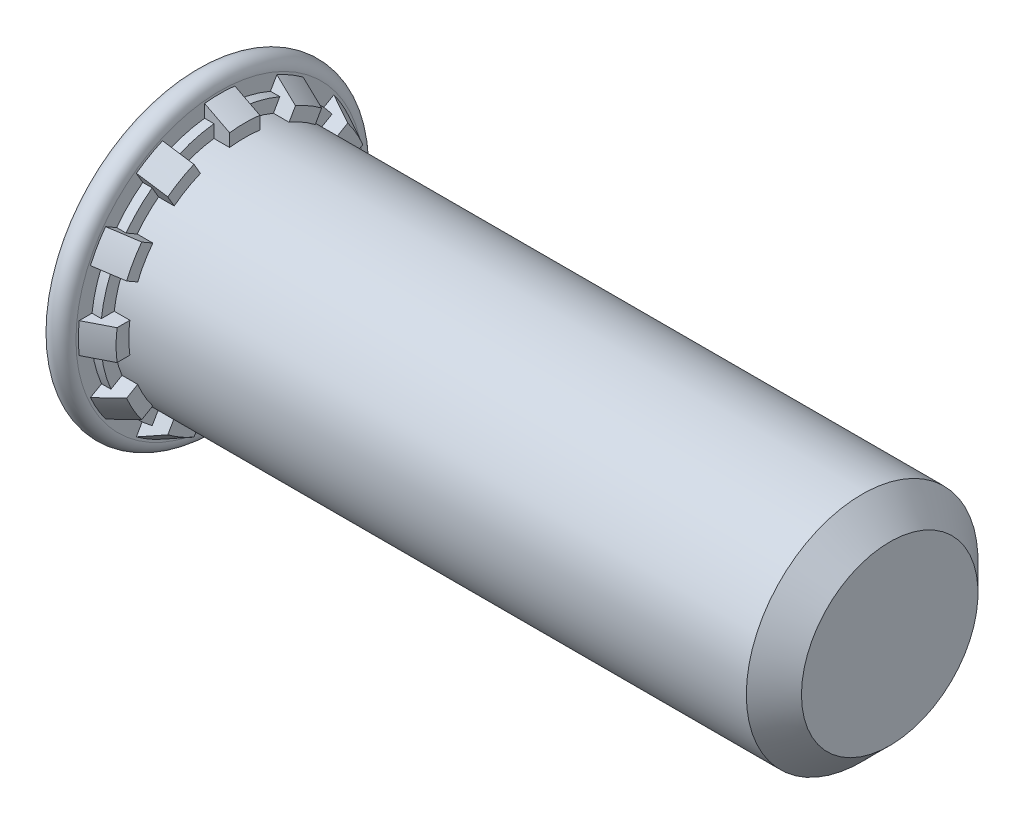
SolidWorks part; units mm, degrees
revolve "BaseBody" add sketch "BodySke" angle 360 about L6
sketch "BodySke" plane through (0, 0, 0) normal (0, 0, 1) x (1, 0, 0)
  line L0 (0, 0) -> (0, 3.9345)
  line L1 (0.6858, 3.9395) -> (0.6858, 3.8735)
  line L2 (0.6858, 3.8735) -> (1.3716, 3.5242)
  line L3 (1.3716, 3.175) -> (18.2943, 3.175)
  line L4 (19.05, 2.4193) -> (19.05, 0)
  line L5 (19.05, 0) -> (0, 0)
  line L6 (0, 0) -> (50.554, 0) construction
  line L7 (1.3716, 3.5242) -> (1.3716, 3.175)
  line L8 (19.05, 2.4193) -> (18.2943, 3.175)
  line L9 (-9.525, 4.2799) -> (9.525, 4.2799) construction
  line L11 (2.6416, 19.05) -> (2.6416, -3.175) construction
  line L13 (9.525, -4.2799) -> (-9.525, -4.2799) construction
  line L14 (0.0051, 3.9395) -> (0.0051, 3.9345)
  line L15 (0, 3.9345) -> (0.0051, 3.9345)
  arc A0 (0.0051, 3.9395) -> (0.6858, 3.9395) centre (0.3454, 3.9395) cw
extrude "RibCut1" cut sketch "RibCut1Ske" against normal blind 0.4286
sketch "RibCut1Ske" plane through (1.3716, 0, 0) normal (1, 0, 0) x (0, 0, -1)
  line L0 (0.4144, 3.1478) -> (0.4144, 4.2598)
  line L1 (1.215, 2.9333) -> (1.771, 3.8963)
  line L2 (0, 0) -> (0, 4.9784) construction
  line L3 (0, 0) -> (0.4144, 3.1478) construction
  line L4 (0, 0) -> (1.215, 2.9333) construction
  arc A1 (1.215, 2.9333) -> (0.4144, 3.1478) centre (0, 0) ccw
  arc A2 (1.771, 3.8963) -> (0.4144, 4.2598) centre (0, 0) ccw
ref_plane "Plane1" through (0, 0, 0) normal (0, 0, 1) x (1, 0, 0)
ref_plane "Plane2" through (0, 0, 0) normal (0, 1, 0) x (1, 0, 0)
ref_plane "Plane3" through (0, 0, 0) normal (1, 0, 0) x (0, 0, -1)
other "Configuration Table"
sketch "ThdSchSke" plane through (0, 0, 0) normal (0, 0, 1) x (1, 0, 0)
  line L0 (3.429, -2.4193) -> (2.8999, -3.175)
  line L1 (3.429, -2.4193) -> (3.9581, -3.175)
  line L2 (3.9581, -3.175) -> (3.9581, -3.9688)
  line L3 (-3.175, 0) -> (5.1513, 0) construction
  line L5 (3.9581, -3.9688) -> (2.8999, -3.9688)
  line L6 (2.8999, -3.9688) -> (2.8999, -3.175)
  line L7 (0, 3.9345) -> (0, -3.9345) construction
revolve "ThreadSchematic" [suppressed] cut sketch "ThdSchSke" angle 360 about L3
pattern_linear "ThdSchPat" [suppressed]
sketch "RibCut2Ske" plane through (1.3716, 0, 0) normal (1, 0, 0) x (0, 0, -1)
  line L0 (0.4144, 3.4998) -> (0.4144, 4.2598)
  line L1 (1.391, 3.2381) -> (1.771, 3.8963)
  line L2 (0.4144, 3.1478) -> (0.4144, 4.9596) construction
  line L3 (0, 0) -> (0, 5.0239) construction
  line L4 (0, 0) -> (0.4144, 3.1478) construction
  line L5 (0, 0) -> (1.215, 2.9333) construction
  line L6 (1.215, 2.9333) -> (2.1244, 4.5085) construction
  arc A1 (1.391, 3.2381) -> (0.4144, 3.4998) centre (0, 0) ccw
  arc A2 (1.771, 3.8963) -> (0.4144, 4.2598) centre (0, 0) ccw
  circle A4 centre (0, 0) radius 3.175 construction
extrude "RibCut2" cut sketch "RibCut2Ske" against normal blind 0.6858
pattern_circular "RibCutsPat" count 12 every 30 about axis through (0, 0, 0) along (1, 0, 0) of "RibCut2", "RibCut1"
equation "' \"Length@BodySke\" = 0.75"
equation "' \"H_dia@BodySke\" = 0.337"
equation "' \"Start@ThdSchSke\" = 0.135"
equation "' \"Diameter@BodySke\" = 0.25"
equation "' \"Minor_dia@BodySke\" =0.1905"
equation "' \"Minor_dia@BodySke\" = 0.1905"
equation "' \"Advance@BodySke\" = 0.05"
equation "\"T_dim@BodySke\" = \"Start@ThdSchSke\" * 0.2"
equation "\"Shoulder_ht@BodySke\" = \"Start@ThdSchSke\" * 0.4"
equation "\"Shoulder_lower_dia@BodySke\" = \"H_dia@BodySke\" - \"Start@ThdSchSke\" * 0.2 - .005"
equation "\"Shoulder_upper_dia@BodySke\" = ( \"Shoulder_lower_dia@BodySke\" + \"Diameter@BodySke\" ) /2"
equation "\"Num_ribs@RibCutsPat\" = 12"
equation "\"Angle@RibCutsPat\" = 360 / \"Num_ribs@RibCutsPat\""
equation "\"Angle@RibCut1Ske\" =\"Angle@RibCutsPat\""
equation "\"Rib_root_half_angle@RibCut1Ske\" = \"Angle@RibCut1Ske\" / 4"
equation "\"Rib_root_gap_angle@RibCut1Ske\" = \"Angle@RibCut1Ske\" - (2 * \"Rib_root_half_angle@RibCut1Ske\" )"
equation "\"Inner_dia@RibCut1Ske\" = \"Diameter@BodySke\""
equation "\"Outer_dia@RibCut1Ske\" = \"H_dia@BodySke\""
equation "\"Depth@RibCut1\" =  \"Start@ThdSchSke\" * 0.125"
equation "\"Angle@RibCut2Ske\" =\"Angle@RibCutsPat\""
equation "\"Rib_root_half_angle@RibCut2Ske\" = \"Angle@RibCut1Ske\" / 4"
equation "\"Rib_root_gap_angle@RibCut2Ske\" = \"Angle@RibCut1Ske\" - (2 * \"Rib_root_half_angle@RibCut1Ske\" )"
equation "\"Rib_root_dia@RibCut2Ske\" = \"Diameter@BodySke\""
equation "\"Inner_dia@RibCut2Ske\" = \"Shoulder_upper_dia@BodySke\""
equation "\"Outer_dia@RibCut2Ske\" = \"H_dia@BodySke\""
equation "\"Depth@RibCut2\" =  \"Start@ThdSchSke\" * 0.2"
equation "\"Thread_length@ThreadCosmetic\" = \"Length@BodySke\" - \"Start@ThdSchSke\""
equation "\"Thread_minor@ThreadCosmetic\" = \"Minor_dia@BodySke\""
equation "\"Thread_minor@ThdSchSke\" = \"Minor_dia@BodySke\""
equation "\"Diameter@ThdSchSke\" = \"Diameter@BodySke\""
equation "\"Overcut@ThdSchSke\" = \"Diameter@BodySke\" * 1.25"
equation "\"Num_threads@ThdSchPat\" = int( \"Thread_length@ThreadCosmetic\" / \"Advance@BodySke\" + 0.999 )  + 1"
equation "\"Advance@ThdSchPat\" = \"Thread_length@ThreadCosmetic\" /  (\"Num_threads@ThdSchPat\" - 1) 'relax it"
equation "\"Num_threads@ThdSchPat\" = \"Num_threads@ThdSchPat\" - sgn( \"Num_threads@ThdSchPat\" - 1) '---chamfered tips only---"
